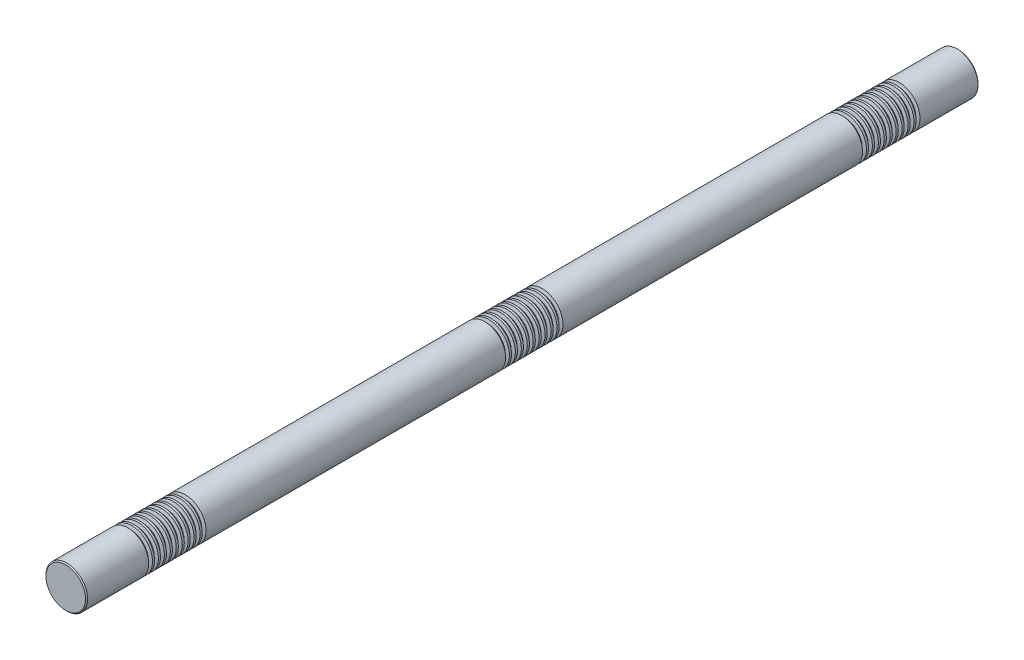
SolidWorks part; units mm, degrees
ref_plane "Front Plane" through (0, 0, 0) normal (0, 0, 1) x (1, 0, 0)
ref_plane "Top Plane" through (0, 0, 0) normal (0, 1, 0) x (1, 0, 0)
ref_plane "Right Plane" through (0, 0, 0) normal (1, 0, 0) x (0, 0, -1)
sketch "Sketch1" plane through (0, 0, 0) normal (0, 0, 1) x (1, 0, 0)
  circle A0 centre (0, 0) radius 35
  dimension "D1" = 70
extrude "Boss-Extrude1" add sketch "Sketch1" along normal mid plane 1500
chamfer "Chamfer1" distance 1.75 angle 45 2 edges at (35, 0, -750) (35, 0, 750)
sketch "Sketch2" plane through (0, 0, 0) normal (1, 0, 0) x (0, 0, -1)
  line L0 (650.7369, 35) -> (644.2631, 35)
  line L1 (748.25, 35) -> (-748.25, 35) construction
  line L2 (644.2631, 35) -> (645.7369, 29.5)
  line L3 (645.7369, 29.5) -> (649.2631, 29.5)
  line L4 (649.2631, 29.5) -> (650.7369, 35)
  line L5 (750, -33.25) -> (750, 33.25) construction
  point P4 (647.5, 35)
  point P7 (647.5, 29.5)
  point P8 (650, 32.25)
  point P9 (645, 32.25)
  dimension "D1" = 5
  dimension "D2" = 100
  dimension "D3" = 5.5
  dimension "D4" = 30
revolve "Cut-Revolve1" cut sketch "Sketch2" angle 360 about axis through (0, 0, 750) along (0, 0, -1)
pattern_linear "LPattern1" count 10 spacing 10 along (0, 0, 1) of "Cut-Revolve1"
pattern_linear "LPattern2" count 3 spacing 600 along (0, 0, 1) of "Cut-Revolve1", "LPattern1"
